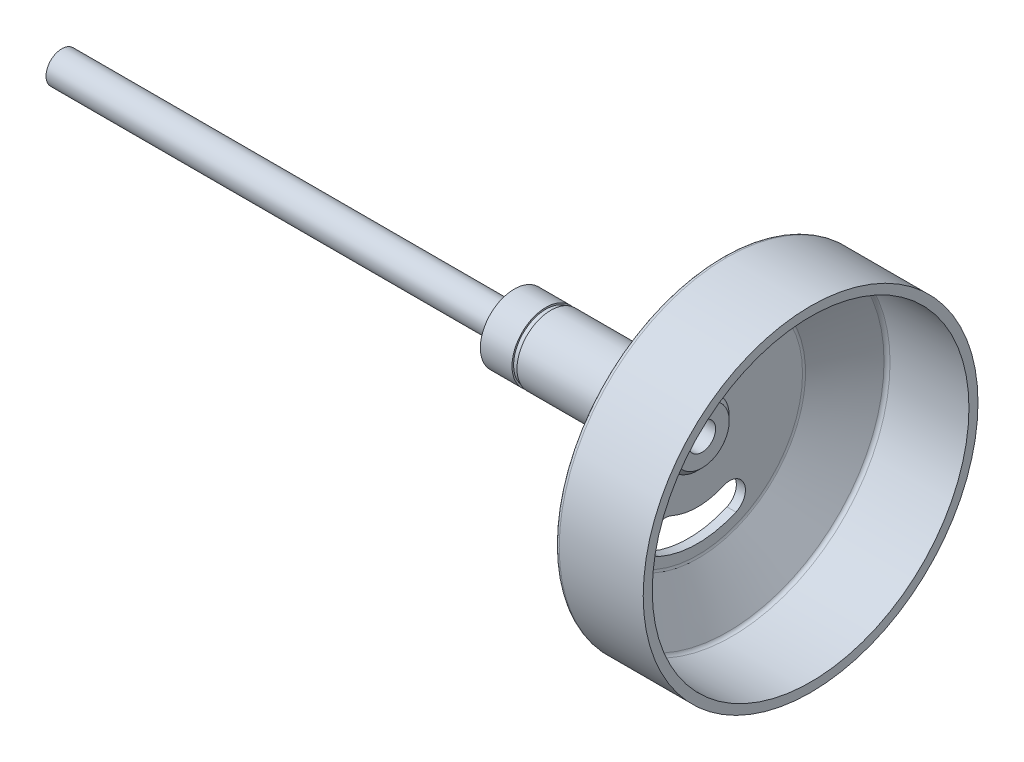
SolidWorks part; units mm, degrees
ref_plane "Plan de face" through (0, 0, 0) normal (0, 0, 1) x (1, 0, 0)
ref_plane "Plan de dessus" through (0, 0, 0) normal (0, 1, 0) x (1, 0, 0)
ref_plane "Plan de droite" through (0, 0, 0) normal (1, 0, 0) x (0, 0, -1)
sketch "Esquisse1" plane through (0, 0, 0) normal (0, 0, 1) x (1, 0, 0)
  line L0 (-9.3038, 0) -> (24.0191, 0) construction
  line L1 (-134.5, 0) -> (-134.5, 3.5)
  line L2 (-134.5, 3.5) -> (-34.5, 3.5)
  line L3 (-34.5, 3.5) -> (-34.5, 7.5)
  line L4 (-34.5, 7.5) -> (-27.5, 7.5)
  line L5 (4, 8.5) -> (4, 23.7804)
  line L6 (4.1458, 24.3004) -> (11.5838, 36.5199)
  line L7 (12.438, 37) -> (31, 37)
  line L8 (31, 37) -> (31, 35)
  line L9 (31, 35) -> (13.562, 35)
  line L10 (12.7078, 34.5199) -> (6.1458, 23.7395)
  line L11 (6, 23.2196) -> (6, 7)
  line L12 (6, 7) -> (6.01, 7)
  line L13 (7, 6.01) -> (7, 3)
  line L14 (7, 3) -> (0, 3)
  line L15 (0, 3) -> (0, 0)
  line L16 (0, 0) -> (-134.5, 0)
  line L17 (6.01, 7) -> (7, 6.01)
  line L18 (-26.4, 7.5) -> (-4.6, 7.5)
  line L20 (-27.5, 7.5) -> (-27.5, 7.15)
  line L21 (-27.5, 7.15) -> (-26.4, 7.15)
  line L22 (-26.4, 7.5) -> (-26.4, 7.15)
  line L23 (-4.6, 7.5) -> (-4.6, 8.5)
  line L25 (-4.6, 8.5) -> (4, 8.5)
  line L26 (-4.6, -9.88) -> (-4.6, -9.5242) construction
  line L27 (-79.5, 12.6368) -> (-79.5, -17.0918) construction
  arc A0 (4, 23.7804) -> (4.1458, 24.3004) centre (5, 23.7804) cw
  arc A1 (6.1458, 23.7395) -> (6, 23.2196) centre (7, 23.2196) ccw
  arc A2 (11.5838, 36.5199) -> (12.438, 37) centre (12.438, 36) cw
  arc A3 (13.562, 35) -> (12.7078, 34.5199) centre (13.562, 34) ccw
  point P16 (7, 7)
  point P27 (6, 23.5)
  point P32 (13, 35)
  dimension "D15" = 1
  dimension "D1" = 7
  dimension "D2" = 15
  dimension "D3" = 74
  dimension "D4" = 70
  dimension "D5" = 47
  dimension "D6" = 14
  dimension "D7" = 6
  dimension "D8" = 7
  dimension "D9" = 1
  dimension "D10" = 2
  dimension "D11" = 18
  dimension "D12" = 2
  dimension "D13" = 100
  dimension "D14" = 25
  dimension "D16" = 45
  dimension "D17" = 52
  dimension "D19" = 14.3
  dimension "D20" = 1.1
  dimension "D21" = 1
revolve "Révolution1" add sketch "Esquisse1" angle 360 about L0
sketch "Esquisse2" plane through (6, 0, 0) normal (1, 0, 0) x (0, 0, -1)
  line L0 (0, -44.0693) -> (0, 43.8784) construction
  line L1 (-7.0887, 36.0318) -> (-7.0887, -23.7395) construction
  arc A0 (-5.671, -12.8) -> (5.671, -12.8) centre (0, 0) ccw
  arc A1 (-8.5065, -19.2) -> (8.5065, -19.2) centre (0, 0) ccw
  arc A2 (-5.671, 12.8) -> (-8.5065, 19.2) centre (-7.0887, 16) cw
  arc A3 (5.671, 12.8) -> (8.5065, 19.2) centre (7.0887, 16) ccw
  arc A4 (-5.671, -12.8) -> (-8.5065, -19.2) centre (-7.0887, -16) ccw
  arc A5 (5.671, -12.8) -> (8.5065, -19.2) centre (7.0887, -16) cw
  arc A6 (5.671, 12.8) -> (-5.671, 12.8) centre (0, 0) ccw
  arc A7 (8.5065, 19.2) -> (-8.5065, 19.2) centre (0, 0) ccw
  point P16 (-7.0887, -12.5)
  point P17 (-7.0887, 12.5)
  dimension "D1" = 28
  dimension "D2" = 7
  dimension "D3" = 25
extrude "Enlèv. mat.-Extru.1" cut sketch "Esquisse2" against normal up to next
